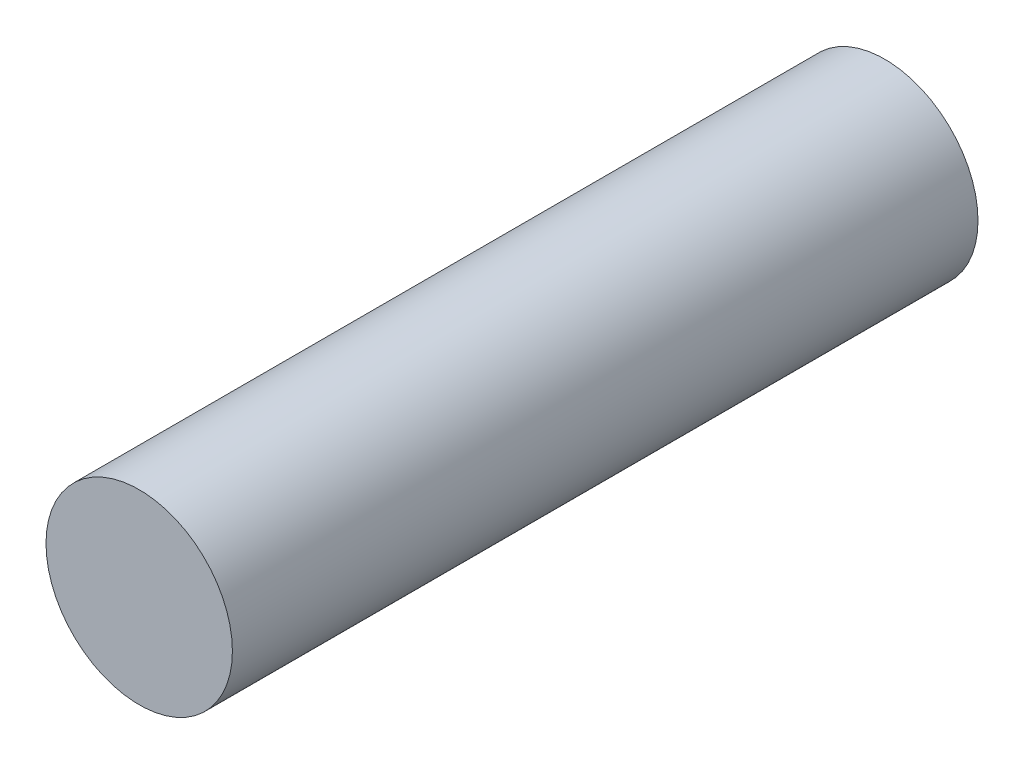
SolidWorks part; units mm, degrees
ref_plane "Ebene vorne" through (0, 0, 0) normal (0, 0, 1) x (1, 0, 0)
ref_plane "Ebene oben" through (0, 0, 0) normal (0, 1, 0) x (1, 0, 0)
ref_plane "Ebene rechts" through (0, 0, 0) normal (1, 0, 0) x (0, 0, -1)
sketch "Skizze1" plane through (0, 0, 0) normal (0, 0, 1) x (1, 0, 0)
  circle A0 centre (0, 0) radius 4.75
  dimension "D1" = 9.5
extrude "Linear austragen1" add sketch "Skizze1" along normal blind 38
